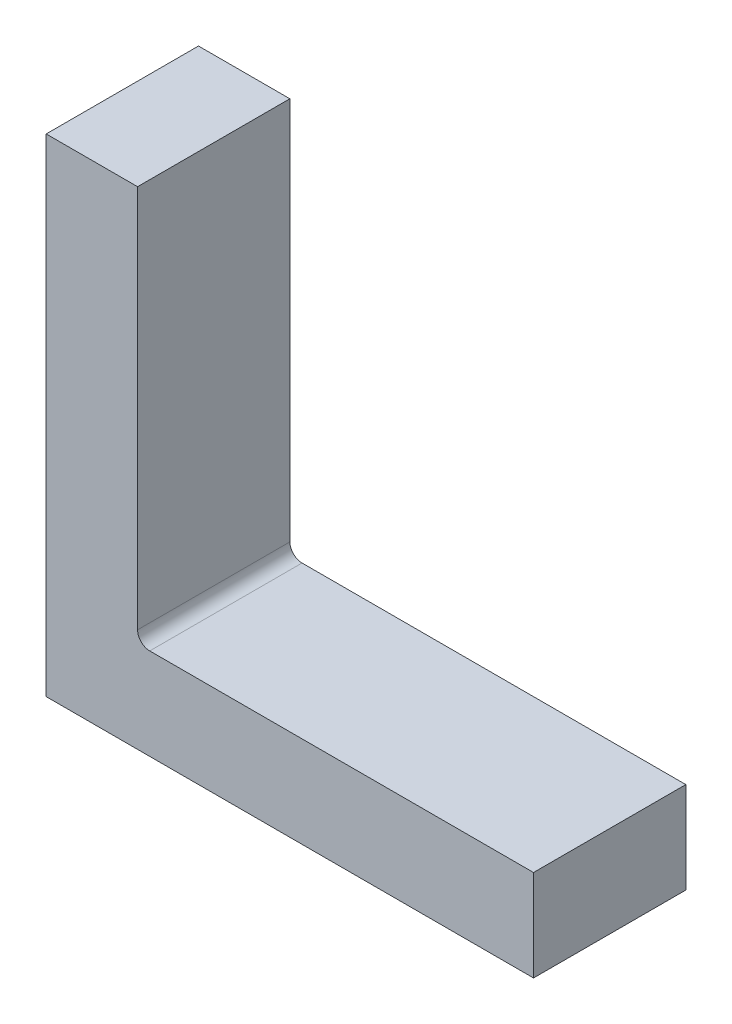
SolidWorks part; units mm, degrees
ref_plane "Front" through (0, 0, 0) normal (0, 0, 1) x (1, 0, 0)
ref_plane "Top" through (0, 0, 0) normal (0, 1, 0) x (1, 0, 0)
ref_plane "Right" through (0, 0, 0) normal (1, 0, 0) x (0, 0, -1)
sketch "Sketch1" plane through (0, 0, 0) normal (0, 0, 1) x (1, 0, 0)
  line L0 (19.05, 101.6) -> (19.05, 19.05)
  line L1 (0, 0) -> (101.6, 0)
  line L2 (0, 0) -> (0, 101.6)
  line L3 (0, 101.6) -> (19.05, 101.6)
  line L4 (101.6, 0) -> (101.6, 19.05)
  line L5 (19.05, 19.05) -> (101.6, 19.05)
  dimension "D1" = 101.6
  dimension "D2" = 101.6
  dimension "D3" = 19.05
  dimension "D4" = 19.05
extrude "Extrude1" add sketch "Sketch1" along normal blind 31.75
fillet "Fillet1" radius 2.54
